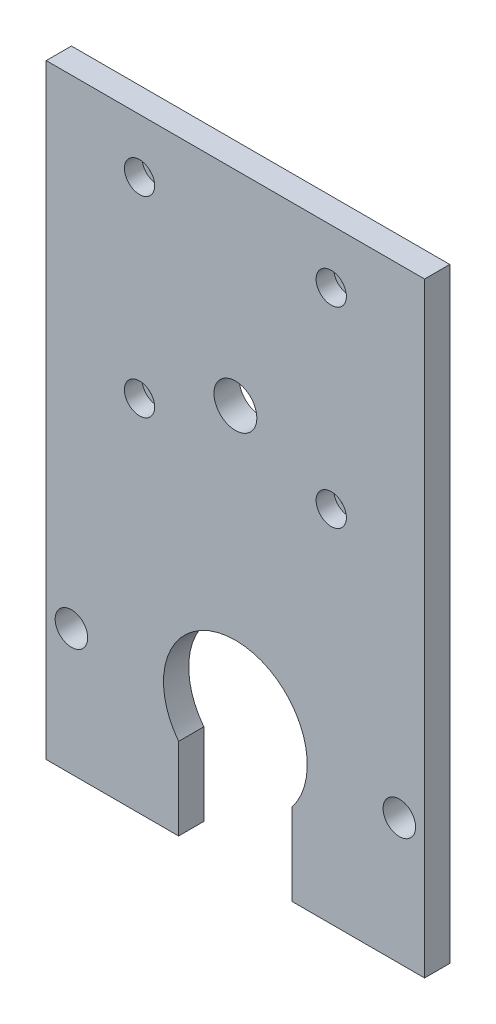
SolidWorks part; units mm, degrees
ref_plane "Face" through (0, 0, 0) normal (0, 0, 1) x (1, 0, 0)
ref_plane "Dessus" through (0, 0, 0) normal (0, 1, 0) x (1, 0, 0)
ref_plane "Droite" through (0, 0, 0) normal (1, 0, 0) x (0, 0, -1)
sketch "Esquisse1" plane through (0, 0, 0) normal (0, 0, 1) x (1, 0, 0)
  line L0 (-22.5, -17.4929) -> (-22.5, -50)
  line L1 (0, -100) -> (0, 210) construction
  line L2 (-22.5, -50) -> (-75, -50)
  line L3 (-75, -50) -> (-75, 190)
  line L4 (-75, 190) -> (75, 190)
  line L5 (0, -5.25) -> (0, 5.25) construction
  line L6 (22.5, -50) -> (75, -50)
  line L7 (22.5, -17.4929) -> (22.5, -50)
  line L8 (75, -50) -> (75, 190)
  arc A0 (22.5, -17.4929) -> (-22.5, -17.4929) centre (0, 0) ccw
  circle A1 centre (0, 109) radius 8.5
  circle A2 centre (65, 0) radius 6.45 construction
  circle A3 centre (-65, 0) radius 6.45 construction
  circle A4 centre (65, 0) radius 6.45
  circle A5 centre (-65, 0) radius 6.45
  point P15 (0, 190)
  dimension "D1" = 57
  dimension "D5" = 17
  dimension "D2" = 22.5
  dimension "D3" = 75
  dimension "D4" = 240
  dimension "D6" = 81
  dimension "D7" = 50
extrude "Base-Extrusion" add sketch "Esquisse1" along normal mid plane 10
sketch "Esquisse7" plane through (0, 0, 5) normal (0, 0, 1) x (1, 0, 0)
  line L0 (-82.1512, 168.5) -> (27.8488, 168.5) construction
  line L1 (-82.1512, 92.5) -> (37.8488, 92.5) construction
  line L2 (-38, 206.2513) -> (-38, 96.2513) construction
  line L3 (38, 206.2513) -> (38, 86.2513) construction
  circle A0 centre (-38, 168.5) radius 4
  dimension "D1" = 76
  dimension "D2" = 76
  dimension "D3" = 59.5
  dimension "D4" = 38
extrude "Enlèv. mat.-Extru.1" cut sketch "Esquisse7" against normal through all
mirror "Symétrie1" about plane through (0, 0, 0) normal (1, 0, 0)
ref_plane "Plan1" through (0, 130.5, 0) normal (0, 1, 0) x (-1, 0, 0)
mirror "Symétrie2" about plane through (0, 130.5, 0) normal (0, 1, 0)
ref_plane "Plan2" through (0, 0, 5) normal (0, 0, 1) x (1, 0, 0)
sketch "Esquisse12" plane through (0, 0, 5) normal (0, 0, 1) x (1, 0, 0)
  circle A0 centre (0, 109) radius 8.5 construction
  point P0 (0, 109)
sketch "Esquisse13" plane through (0, 0, 5) normal (0, 0, 1) x (1, 0, 0)
  circle A0 centre (38, 168.5) radius 6
  circle A1 centre (38, 168.5) radius 4 construction
  dimension "D1" = 12
extrude "Enlèv. mat.-Extru.2" cut sketch "Esquisse13" against normal blind 7
mirror "Symétrie3" about plane through (0, 0, 0) normal (1, 0, 0)
mirror "Symétrie4" about plane through (0, 130.5, 0) normal (0, 1, 0)
